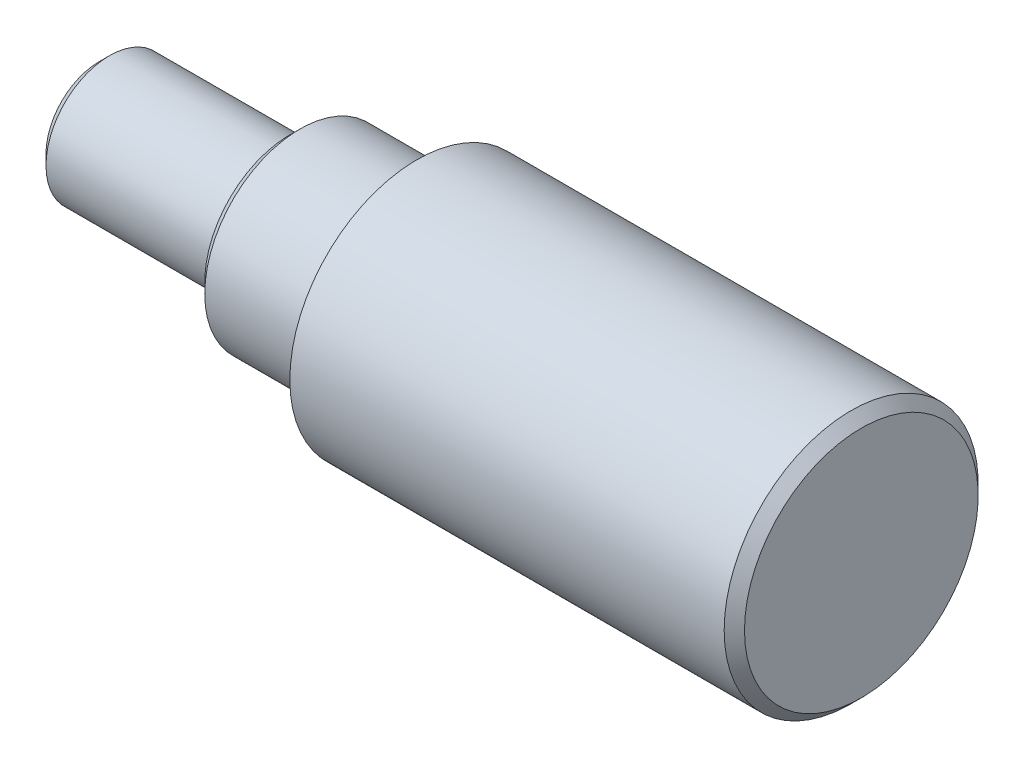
SolidWorks part; units mm, degrees
ref_plane "Front Plane" through (0, 0, 0) normal (0, 0, 1) x (1, 0, 0)
ref_plane "Top Plane" through (0, 0, 0) normal (0, 1, 0) x (1, 0, 0)
ref_plane "Right Plane" through (0, 0, 0) normal (1, 0, 0) x (0, 0, -1)
sketch "Sketch1" plane through (0, 0, 0) normal (0, 0, 1) x (1, 0, 0)
  line L0 (0, 0) -> (94.8406, 0) construction
  line L1 (0, 0) -> (0, 3.175)
  line L2 (0, 3.175) -> (9.525, 3.175)
  line L3 (9.525, 3.175) -> (9.525, 4.7625)
  line L4 (9.525, 4.7625) -> (15.875, 4.7625)
  line L5 (15.875, 4.7625) -> (15.875, 6.35)
  line L6 (15.875, 6.35) -> (38.1, 6.35)
  line L7 (38.1, 6.35) -> (38.1, 0)
  line L8 (38.1, 0) -> (0, 0)
  dimension "D1" = 9.525
  dimension "D2" = 6.35
  dimension "D3" = 38.1
  dimension "D4" = 6.35
  dimension "D5" = 9.525
  dimension "D6" = 12.7
revolve "Revolve1" add sketch "Sketch1" angle 360 about L0
chamfer "Chamfer1" distance 0.508 angle 45 3 edges at (9.525, 0, 4.7625) (0, 0, 3.175) (38.1, 0, 6.35)
